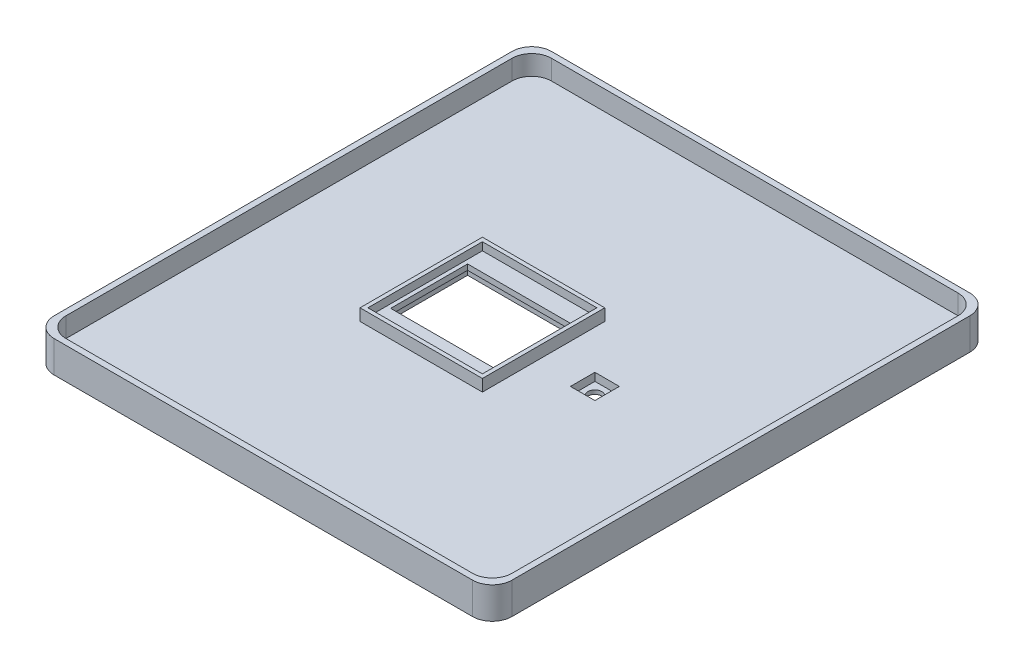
SolidWorks part; units mm, degrees
ref_plane "Front Plane" through (0, 0, 0) normal (0, 0, 1) x (1, 0, 0)
ref_plane "Top Plane" through (0, 0, 0) normal (0, 1, 0) x (1, 0, 0)
ref_plane "Right Plane" through (0, 0, 0) normal (1, 0, 0) x (0, 0, -1)
sketch "Sketch1" plane through (0, 0, 0) normal (0, 1, 0) x (1, 0, 0)
  line L1 (58, -63) -> (-58, -63)
  line L2 (58, -63) -> (58, 63)
  line L3 (58, 63) -> (-58, 63)
  line L4 (-58, -63) -> (-58, 63)
  line L5 (58, -63) -> (-58, 63) construction
  line L6 (58, 63) -> (-58, -63) construction
  point P0 (0, 0)
  dimension "D1" = 126
  dimension "D2" = 116
extrude "Boss-Extrude1" add sketch "Sketch1" along normal blind 3
sketch "Sketch2" plane through (0, 3, 0) normal (0, 1, 0) x (1, 0, 0)
  line L1 (58, -63) -> (-58, -63)
  line L2 (58, -63) -> (58, 63)
  line L3 (58, 63) -> (-58, 63)
  line L4 (-58, -63) -> (-58, 63)
  line L5 (58, -63) -> (-58, 63) construction
  line L6 (58, 63) -> (-58, -63) construction
  line L7 (56.5, -61.5) -> (-56.5, -61.5)
  line L8 (56.5, -61.5) -> (56.5, 61.5)
  line L9 (56.5, 61.5) -> (-56.5, 61.5)
  line L10 (-56.5, -61.5) -> (-56.5, 61.5)
  line L11 (56.5, -61.5) -> (-56.5, 61.5) construction
  line L12 (56.5, 61.5) -> (-56.5, -61.5) construction
  point P0 (0, 0)
  point P7 (0, 0)
  dimension "D1" = 113
  dimension "D2" = 123
extrude "Boss-Extrude2" add sketch "Sketch2" along normal blind 5
fillet "Fillet1" radius 5 8 edges at (56.5, 5.5, -61.5) (-56.5, 5.5, -61.5) (56.5, 5.5, 61.5) (58, 4, 63) (-58, 4, -63) (58, 4, -63) (-56.5, 5.5, 61.5) (-58, 4, 63)
sketch "Sketch3" plane through (0, 0, 0) normal (0, -1, 0) x (1, 0, 0)
  line L0 (-21, 0) -> (-7.5, 0) construction
  line L1 (6, -9.75) -> (-21, -9.75)
  line L2 (6, -9.75) -> (6, 9.75)
  line L3 (6, 9.75) -> (-21, 9.75)
  line L4 (-21, -9.75) -> (-21, 9.75)
  line L5 (6, -9.75) -> (-21, 9.75) construction
  line L6 (6, 9.75) -> (-21, -9.75) construction
  line L7 (-7.5, 0) -> (6, 0) construction
  line L8 (6, 0) -> (36, 0) construction
  line L11 (-58, 58) -> (58, 58)
  line L12 (-58, -58) -> (-58, 58) construction
  line L14 (-53, 63) -> (53, 63) construction
  circle A0 centre (21, 0) radius 1.75
  point P0 (-7.5, 0)
  point P13 (0, 0)
  dimension "D4" = 3.5
  dimension "D1" = 27
  dimension "D2" = 19.5
  dimension "D3" = 30
  dimension "D5" = 42
  dimension "D6" = 116
  dimension "D7" = 37
  dimension "D9" = 53.25
extrude "Cut-Extrude1" cut sketch "Sketch3" against normal blind 5 contours L4 L1 L2 L3 | A0
sketch "Sketch4" plane through (0, 0, 0) normal (0, -1, 0) x (1, 0, 0)
  line L0 (-58, -58) -> (-58, 58) construction
  text T0 "Analyse Eau Piscine" font "Product Sans" height 8
  dimension "D1" = 10.5
extrude "Cut-Extrude2" cut sketch "Sketch4" against normal blind 1
sketch "Sketch5" plane through (0, 0, 0) normal (0, -1, 0) x (1, 0, 0)
  line L0 (-21, 9.75) -> (6, -9.75) construction
  line L2 (7.5, -11.25) -> (-22.5, -11.25)
  line L3 (7.5, -11.25) -> (7.5, 11.25)
  line L4 (7.5, 11.25) -> (-22.5, 11.25)
  line L5 (-22.5, -11.25) -> (-22.5, 11.25)
  line L6 (7.5, -11.25) -> (-22.5, 11.25) construction
  line L7 (7.5, 11.25) -> (-22.5, -11.25) construction
  point P4 (-7.5, 0)
  dimension "D1" = 30
  dimension "D2" = 22.5
extrude "Cut-Extrude3" cut sketch "Sketch5" against normal blind 2.6
sketch "Sketch6" plane through (0, 3, 0) normal (0, 1, 0) x (1, 0, 0)
  line L0 (-21, 9.75) -> (6, -9.75) construction
  line L2 (7, -14.5) -> (-22, -14.5)
  line L3 (7, -14.5) -> (7, 14.5)
  line L4 (7, 14.5) -> (-22, 14.5)
  line L5 (-22, -14.5) -> (-22, 14.5)
  line L6 (7, -14.5) -> (-22, 14.5) construction
  line L7 (7, 14.5) -> (-22, -14.5) construction
  line L8 (8, -15.5) -> (-23, -15.5)
  line L9 (8, -15.5) -> (8, 15.5)
  line L10 (8, 15.5) -> (-23, 15.5)
  line L11 (-23, -15.5) -> (-23, 15.5)
  line L12 (8, -15.5) -> (-23, 15.5) construction
  line L13 (8, 15.5) -> (-23, -15.5) construction
  point P4 (-7.5, 0)
  point P9 (-7.5, 0)
  dimension "D1" = 29
  dimension "D2" = 29
  dimension "D3" = 31
  dimension "D4" = 31
extrude "Boss-Extrude3" add sketch "Sketch6" along normal blind 3
sketch "Sketch7" plane through (0, 3, 0) normal (0, 1, 0) x (1, 0, 0)
  line L1 (-22, 14.5) -> (7, 14.5)
  line L2 (-22, 14.5) -> (-22, -14.5)
  line L3 (-22, -14.5) -> (7, -14.5)
  line L4 (7, 14.5) -> (7, -14.5)
  line L5 (-21, 9.75) -> (6, 9.75)
  line L6 (-21, 9.75) -> (-21, -9.75)
  line L7 (-21, -9.75) -> (6, -9.75)
  line L8 (6, 9.75) -> (6, -9.75)
extrude "Boss-Extrude4" add sketch "Sketch7" along normal blind 1
sketch "Sketch8" plane through (0, 3, 0) normal (0, 1, 0) x (1, 0, 0)
  line L1 (24.1, -3.1) -> (17.9, -3.1)
  line L2 (24.1, -3.1) -> (24.1, 3.1)
  line L3 (24.1, 3.1) -> (17.9, 3.1)
  line L4 (17.9, -3.1) -> (17.9, 3.1)
  line L5 (24.1, -3.1) -> (17.9, 3.1) construction
  line L6 (24.1, 3.1) -> (17.9, -3.1) construction
  point P0 (21, 0)
  dimension "D1" = 6.2
  dimension "D2" = 6.2
extrude "Cut-Extrude4" cut sketch "Sketch8" against normal blind 2
